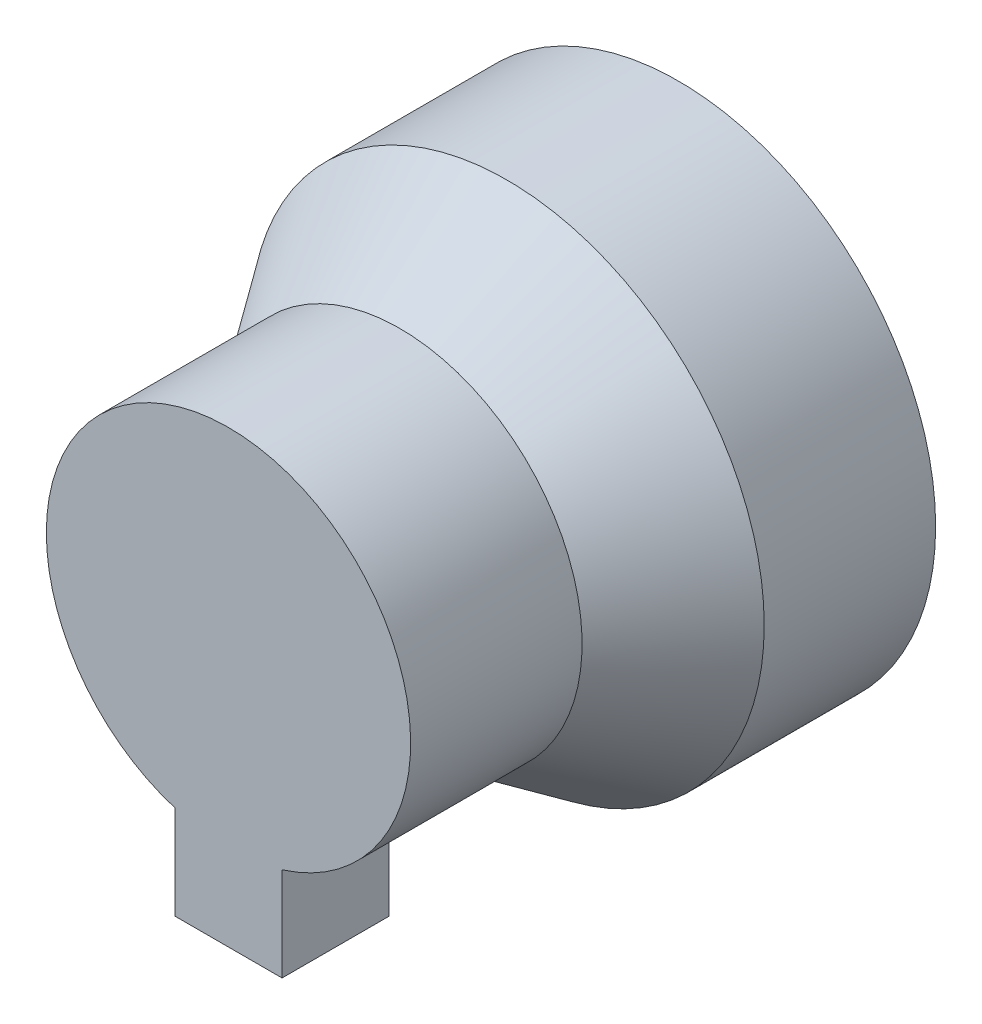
SolidWorks part; units mm, degrees
ref_plane "前视基准面" through (0, 0, 0) normal (0, 0, 1) x (1, 0, 0)
ref_plane "上视基准面" through (0, 0, 0) normal (0, 1, 0) x (1, 0, 0)
ref_plane "右视基准面" through (0, 0, 0) normal (1, 0, 0) x (0, 0, -1)
sketch "草图1" plane through (0, 0, 0) normal (1, 0, 0) x (0, 0, -1)
  line L6 (-21, 0) -> (-21, 8.5)
  line L7 (-13, 8.5) -> (-21, 8.5)
  line L8 (-8, 12) -> (-13, 8.5)
  line L9 (0, 12) -> (-8, 12)
  line L10 (0, 0) -> (0, 12)
  line L11 (0, 0) -> (-21, 0)
ref_plane "基准面5" through (0, -12.5, 0) normal (0, 1, 0) x (1, 0, 0)
sketch "草图2" plane through (0, -12.5, 0) normal (0, 1, 0) x (1, 0, 0)
  line L4 (2.5, -21) -> (-2.5, -21)
  line L5 (2.5, -16) -> (2.5, -21)
  line L6 (2.5, -16) -> (-2.5, -16)
  line L7 (-2.5, -16) -> (-2.5, -21)
revolve "旋转3" add sketch "草图1" angle 360 about L11
extrude "凸台-拉伸3" add sketch "草图2" along normal blind 10 contours L7 L4 L5 L6
shell "抽壳1" thickness 0.5
